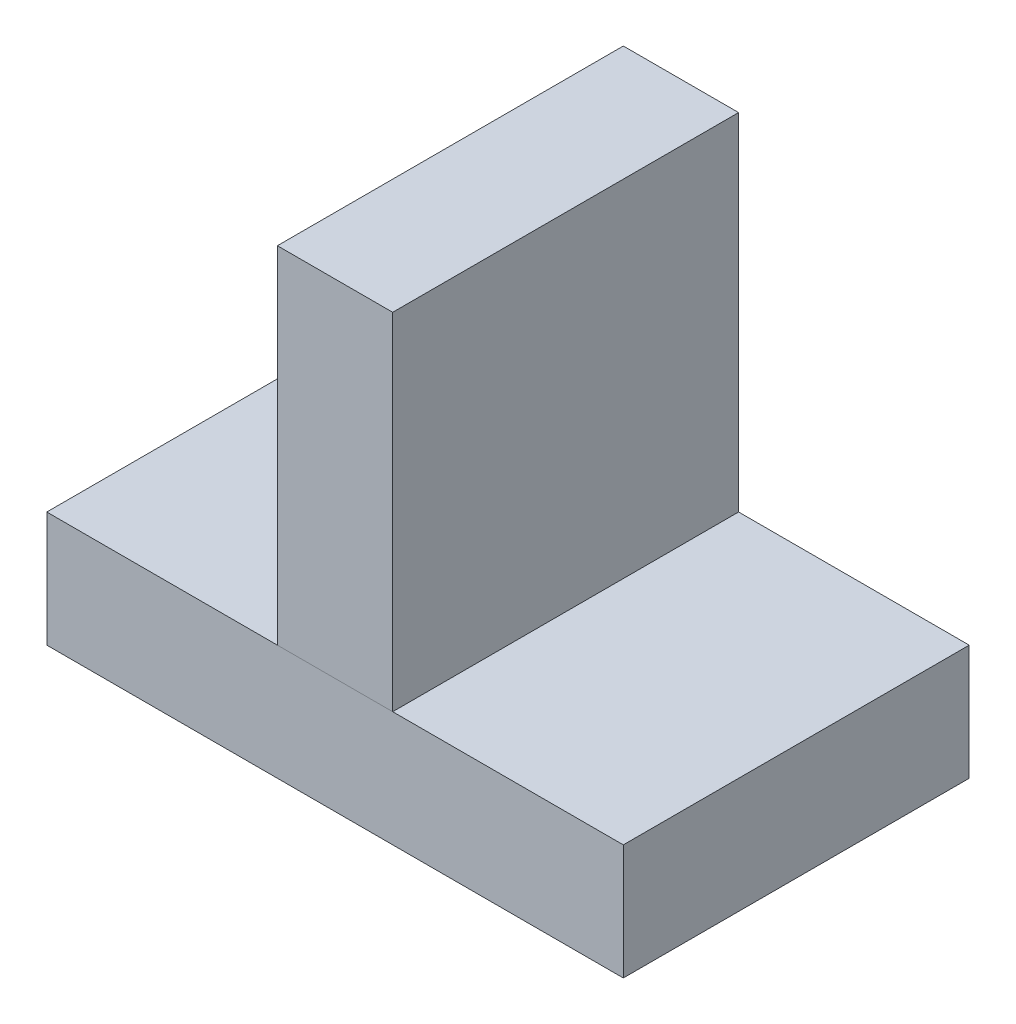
SolidWorks part; units mm, degrees
ref_plane "正面" through (0, 0, 0) normal (0, 0, 1) x (1, 0, 0)
ref_plane "平面" through (0, 0, 0) normal (0, 1, 0) x (1, 0, 0)
ref_plane "右側面" through (0, 0, 0) normal (1, 0, 0) x (0, 0, -1)
sketch "ｽｹｯﾁ1" plane through (0, 0, 0) normal (0, 1, 0) x (1, 0, 0)
  line L1 (-25, -15) -> (25, -15)
  line L2 (-25, -15) -> (-25, 15)
  line L3 (-25, 15) -> (25, 15)
  line L4 (25, -15) -> (25, 15)
  line L5 (-25, -15) -> (25, 15) construction
  line L6 (-25, 15) -> (25, -15) construction
  point P0 (0, 0)
  dimension "D1" = 50
  dimension "D2" = 30
extrude "ﾎﾞｽ - 押し出し1" add sketch "ｽｹｯﾁ1" along normal blind 10
sketch "ｽｹｯﾁ4" plane through (0, 0, 0) normal (0, 0, 1) x (1, 0, 0)
  line L0 (-25, 10) -> (25, 10) construction
  line L1 (-5, 40) -> (5, 40)
  line L2 (-5, 40) -> (-5, 10)
  line L3 (-5, 10) -> (5, 10)
  line L4 (5, 40) -> (5, 10)
  point P4 (0, 10)
  dimension "D1" = 10
  dimension "D2" = 30
extrude "ﾎﾞｽ - 押し出し2" add sketch "ｽｹｯﾁ4" along normal mid plane 30 separate body
